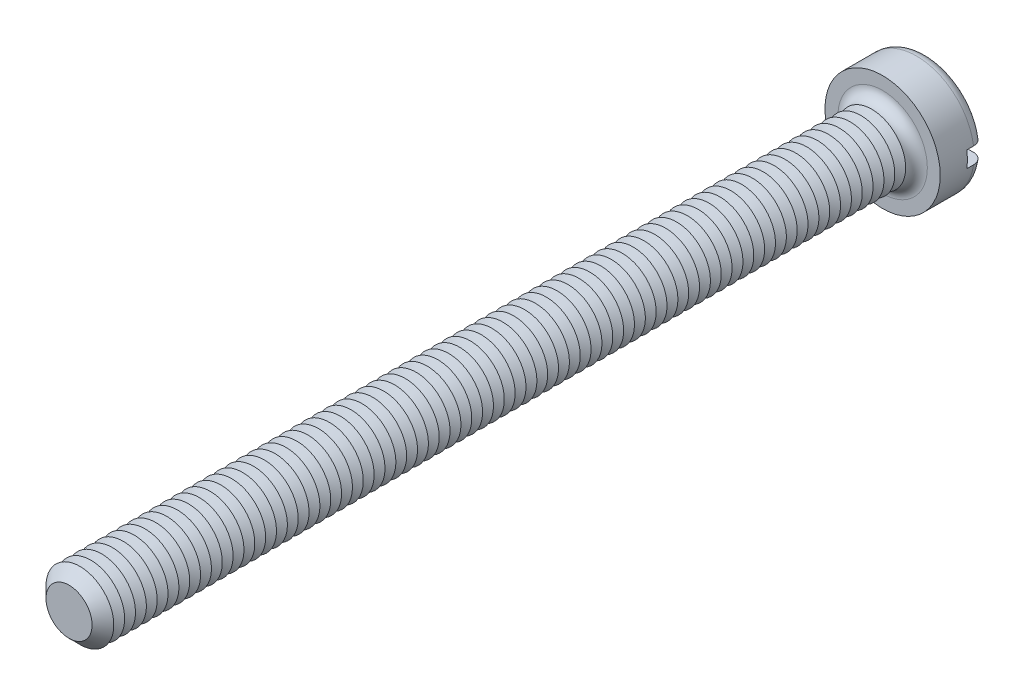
SolidWorks part; units mm, degrees
ref_plane "Front Plane" through (0, 0, 0) normal (0, 0, 1) x (1, 0, 0)
ref_plane "Top Plane" through (0, 0, 0) normal (0, 1, 0) x (1, 0, 0)
ref_plane "Right Plane" through (0, 0, 0) normal (1, 0, 0) x (0, 0, -1)
sketch "Sketch3" plane through (0, 0, 0) normal (0, 0, 1) x (1, 0, 0)
  circle A0 centre (0, 0) radius 4.25
  dimension "D1" = 8.5
extrude "Boss-Extrude2" add sketch "Sketch3" against normal blind 3.3
sketch "Sketch4" plane through (0, 0, 0) normal (0, 0, 1) x (1, 0, 0)
  circle A0 centre (0, 0) radius 2.5
  dimension "D1" = 5
extrude "Boss-Extrude3" add sketch "Sketch4" along normal blind 60
fillet "Fillet1" radius 0.8 2 edges at (4.25, 0, -3.3) (2.5, 0, 0)
chamfer "Chamfer1" distance 0.8 angle 45 1 edges at (2.5, 0, 60)
sketch "Sketch5" plane through (0, 0, 0) normal (1, 0, 0) x (0, 0, -1)
  line L0 (1.6944, 0) -> (-7.6738, 0) construction
sketch "Sketch6" plane through (0, 0, 0) normal (1, 0, 0) x (0, 0, -1)
  line L0 (-0.8, 2.5) -> (-1.2, 1.8072)
  line L1 (-1.2, 1.8072) -> (-1.6, 2.5)
  line L2 (-0.8, 2.5) -> (-59.2, 2.5) construction
  line L3 (-1.6, 2.5) -> (-0.8, 2.5)
  dimension "D1" = 0.8
revolve "Cut-Revolve1" cut sketch "Sketch6" angle 360 about L0
pattern_linear "LPattern1" count 73 spacing 0.8 along (0, 0, 1) of "Cut-Revolve1"
sketch "Sketch8" plane through (0, 0, -3.3) normal (0, 0, -1) x (-1, 0, 0)
  line L1 (4.25, -0.6) -> (-4.25, -0.6)
  line L2 (4.25, -0.6) -> (4.25, 0.6)
  line L3 (4.25, 0.6) -> (-4.25, 0.6)
  line L4 (-4.25, -0.6) -> (-4.25, 0.6)
  line L5 (4.25, -0.6) -> (-4.25, 0.6) construction
  line L6 (4.25, 0.6) -> (-4.25, -0.6) construction
  point P0 (0, 0)
  dimension "D1" = 8.5
  dimension "D2" = 1.2
extrude "Cut-Extrude1" cut sketch "Sketch8" against normal blind 1.3
